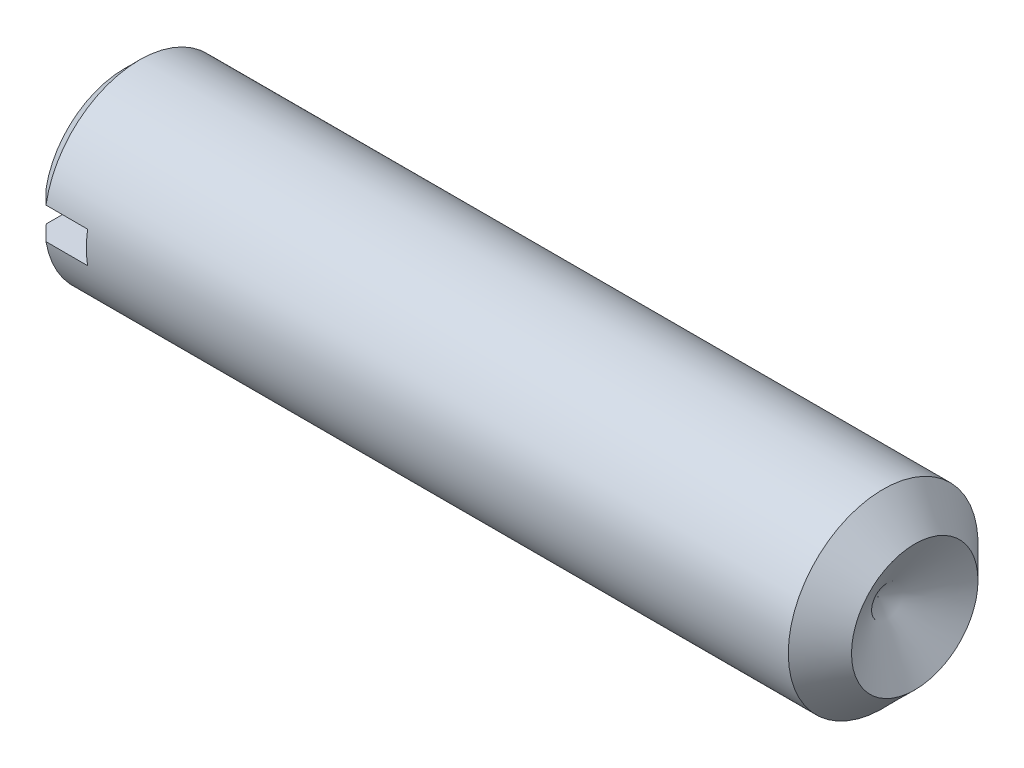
SolidWorks part; units mm, degrees
ref_plane "Front Plane" through (0, 0, 0) normal (0, 0, 1) x (1, 0, 0)
ref_plane "Top Plane" through (0, 0, 0) normal (0, 1, 0) x (1, 0, 0)
ref_plane "Right Plane" through (0, 0, 0) normal (1, 0, 0) x (0, 0, -1)
sketch "BodySke" plane through (0, 0, 0) normal (0, 0, 1) x (1, 0, 0)
  line L0 (0, 0) -> (88.3411, 0) construction
  line L1 (0, 0) -> (0, 5.036)
  line L2 (0, 5.036) -> (0.964, 6)
  line L3 (0.964, 6) -> (48, 6)
  line L4 (50, 4) -> (48, 6)
  line L5 (0, -5.036) -> (0.964, -6) construction
  line L6 (47.6906, 0) -> (0, 0)
  line L7 (1.75, 0) -> (1.75, 8.5388) construction
  line L8 (50, 4) -> (47.6906, 0)
  line L9 (50, -4) -> (47.6906, 0) construction
  dimension "Diameter" = 12
  dimension "Thread_minor" = 10.072
  dimension "Length" = 50
  dimension "Cup_dia" = 8
  dimension "Nose_chamfer_angle" = 45
  dimension "Drive_chamfer_angle" = 90
  dimension "Advance" = 1.75
  dimension "Cup_angle" = 120
revolve "BaseBody" add sketch "BodySke" angle 360 about L0
sketch "SlotSke" plane through (0, 0, 0) normal (1, 0, 0) x (0, 0, -1)
  line L0 (-6, 1) -> (6, -1) construction
  line L1 (-6, 1) -> (6, 1)
  line L2 (-6, 1) -> (-6, -1)
  line L3 (-6, -1) -> (6, -1)
  line L4 (6, 1) -> (6, -1)
  dimension "D1" = 12
  dimension "Slot_width" = 2
extrude "Slot" cut sketch "SlotSke" along normal blind 3.6
sketch "ThdSchSke" plane through (0, 0, 0) normal (0, 0, 1) x (1, 0, 0)
  line L0 (0, 0) -> (53.6961, 0) construction
  line L1 (1.6009, 7.1131) -> (1.6009, 6)
  line L2 (1.6009, 7.1131) -> (2.714, 7.1131)
  line L3 (2.714, 7.1131) -> (2.714, 6)
  line L4 (2.714, 6) -> (2.1574, 5.036)
  line L5 (2.1574, 5.036) -> (1.6009, 6)
  dimension "D1" = 1.75
revolve "ThreadSchematic" [suppressed] cut sketch "ThdSchSke" angle 360 about L0
pattern_linear "ThdSchPat" [suppressed]
equation "\"Thread_minor@ThreadCosmetic\" = \"Thread_minor@BodySke\""
equation "\"D1@SlotSke\" = \"Diameter@BodySke\""
equation "\"D1@ThdSchSke\" = \"Advance@BodySke\""
equation "\"Advance@ThdSchPat\" = \"Advance@BodySke\""
equation "\"Tooth_Num@ThdSchPat\" =  int( \"Length@BodySke\" / \"Advance@BodySke\" )  - 1"
